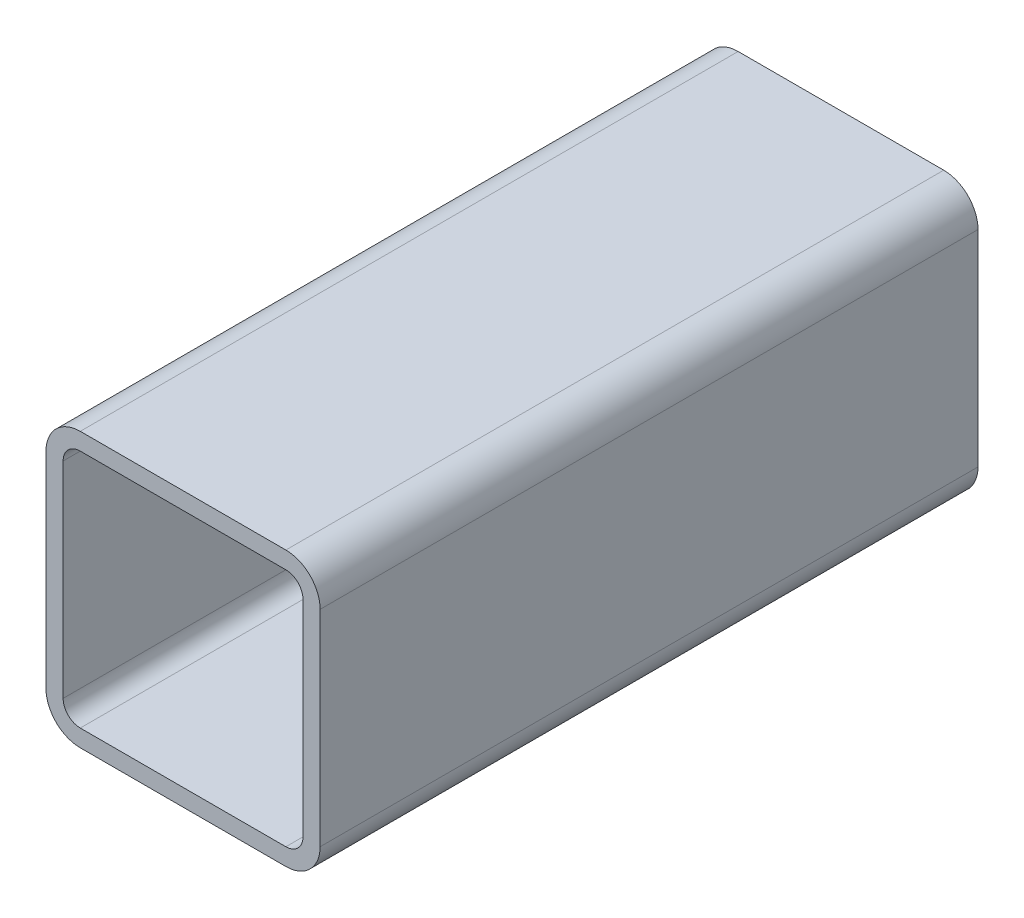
SolidWorks part; units mm, degrees
ref_plane "Front Plane" through (0, 0, 0) normal (0, 0, 1) x (1, 0, 0)
ref_plane "Top Plane" through (0, 0, 0) normal (0, 1, 0) x (1, 0, 0)
ref_plane "Right Plane" through (0, 0, 0) normal (1, 0, 0) x (0, 0, -1)
sketch "Sketch1" plane through (0, 0, 0) normal (0, 0, 1) x (1, 0, 0)
sketch_block_instance "HSS5x5x0.3125-1"
sketch_block "HSS5x5x0.3125"
extrude "Boss-Extrude1" add sketch "Sketch1" along normal blind 304.8
